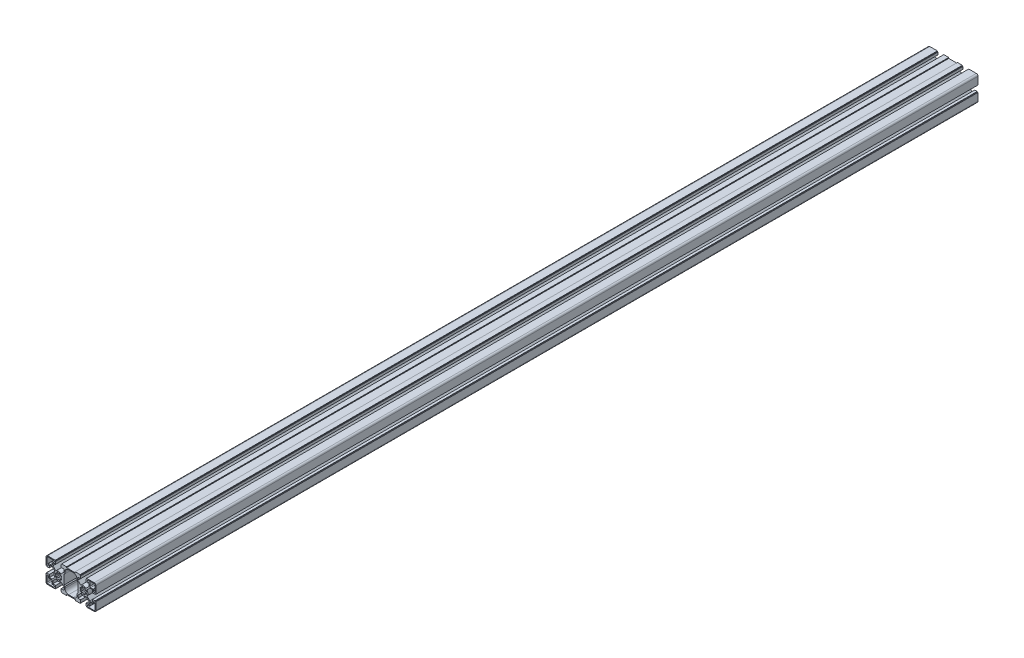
SolidWorks part; units mm, degrees
ref_plane "Front Plane" through (0, 0, 0) normal (0, 0, 1) x (1, 0, 0)
ref_plane "Top Plane" through (0, 0, 0) normal (0, 1, 0) x (1, 0, 0)
ref_plane "Right Plane" through (0, 0, 0) normal (1, 0, 0) x (0, 0, -1)
sketch "Sketch1" plane through (0, 0, 0) normal (0, 0, 1) x (1, 0, 0)
  line L0 (-27.5082, 0) -> (-17.5006, 0) construction
  line L1 (17.5006, 0) -> (27.5082, 0) construction
  line L2 (-42.0116, 22.5044) -> (-28.2956, 22.5044)
  line L3 (-28.2956, 22.5044) -> (-28.2956, 21.0058)
  line L4 (-28.2956, 21.0058) -> (-27.5082, 21.0058)
  line L5 (22.5044, -5.0038) -> (22.5044, 5.0038) construction
  line L6 (-27.5082, 21.0058) -> (-27.5082, 16.51)
  line L7 (-27.5082, 16.51) -> (-32.5501, 16.51)
  line L8 (-32.5501, 16.51) -> (-32.5501, 11.6801)
  line L9 (-32.5501, 11.6801) -> (-27.2854, 6.4154)
  line L11 (-34.1845, 10.0457) -> (-28.9198, 4.781)
  line L12 (-39.0144, 10.0457) -> (-34.1845, 10.0457)
  line L13 (-39.0144, 5.0038) -> (-39.0144, 10.0457)
  line L14 (-43.5102, 5.0038) -> (-39.0144, 5.0038)
  line L15 (-43.5102, 5.7912) -> (-43.5102, 5.0038)
  line L16 (-45.0088, 5.7912) -> (-43.5102, 5.7912)
  line L17 (-45.0088, 19.5072) -> (-45.0088, 5.7912)
  line L18 (-40.513, 11.5443) -> (-35.5473, 11.5443)
  line L19 (-40.513, 11.5443) -> (-40.513, 8.7884)
  line L20 (-34.0487, 18.0086) -> (-34.0487, 13.0429)
  line L21 (-43.5102, 19.5072) -> (-43.5102, 8.7884)
  line L23 (-34.0487, 18.0086) -> (-31.2928, 18.0086)
  line L24 (-42.0116, 21.0058) -> (-31.2928, 21.0058)
  line L25 (-21.3151, 5.9789) -> (-21.5282, 4.9077)
  line L26 (-23.6937, 5.9789) -> (-23.4806, 4.9077)
  line L27 (-17.4358, 3.3868) -> (-18.3439, 2.78)
  line L28 (-19.1176, 5.0686) -> (-19.7244, 4.1605)
  line L29 (-16.5255, -1.1893) -> (-17.5967, -0.9762)
  line L30 (-16.5255, 1.1893) -> (-17.5967, 0.9762)
  line L31 (-19.1176, -5.0686) -> (-19.7244, -4.1605)
  line L32 (-17.4358, -3.3868) -> (-18.3439, -2.78)
  line L33 (-23.6937, -5.9789) -> (-23.4806, -4.9077)
  line L34 (-21.3151, -5.9789) -> (-21.5282, -4.9077)
  line L35 (-27.573, -3.3868) -> (-26.6649, -2.78)
  line L36 (-25.8912, -5.0686) -> (-25.2844, -4.1605)
  line L37 (-28.4833, 1.1893) -> (-27.4121, 0.9762)
  line L38 (-28.4833, -1.1893) -> (-27.4121, -0.9762)
  line L39 (-25.8912, 5.0686) -> (-25.2844, 4.1605)
  line L40 (-27.573, 3.3868) -> (-26.6649, 2.78)
  line L41 (-7.8105, 22.5044) -> (-7.8105, 21.0058)
  line L42 (-7.8105, 21.0058) -> (7.8105, 21.0058)
  line L43 (-7.8105, 22.5044) -> (-16.7132, 22.5044)
  line L44 (-16.7132, 22.5044) -> (-16.7132, 21.0058)
  line L45 (-16.7132, 21.0058) -> (-17.5006, 21.0058)
  line L46 (-17.5006, 21.0058) -> (-17.5006, 16.51)
  line L47 (-17.5006, 16.51) -> (-12.4587, 16.51)
  line L48 (-12.4587, 16.51) -> (-12.4587, 11.6801)
  line L49 (-12.4587, 11.6801) -> (-17.7234, 6.4154)
  line L50 (-10.9601, 9.9099) -> (-12.4587, 8.4113)
  line L51 (7.8105, 21.0058) -> (7.8105, 22.5044)
  line L53 (-7.8105, -22.5044) -> (-16.7132, -22.5044)
  line L54 (7.8105, -22.5044) -> (16.7132, -22.5044)
  line L55 (7.8105, -21.0058) -> (7.8105, -22.5044)
  line L56 (-7.8105, -21.0058) -> (7.8105, -21.0058)
  line L57 (-7.8105, -22.5044) -> (-7.8105, -21.0058)
  line L58 (-40.513, -11.5443) -> (-35.5473, -11.5443)
  line L59 (4.3561, 19.5072) -> (-4.3561, 19.5072)
  line L60 (-10.9601, 12.9032) -> (-10.9601, 9.9099)
  line L61 (-12.4587, -8.4113) -> (-10.9601, -9.9099)
  line L62 (-12.4587, 8.4113) -> (-12.4587, -8.4113)
  line L63 (-10.9601, -12.9032) -> (-10.9601, -9.9099)
  line L64 (4.3561, -19.5072) -> (-4.3561, -19.5072)
  line L65 (10.9601, 12.9032) -> (10.9601, 9.9099)
  line L66 (10.9601, -12.9032) -> (10.9601, -9.9099)
  line L67 (12.4587, 8.4113) -> (12.4587, -8.4113)
  line L68 (10.9601, -9.9099) -> (12.4587, -8.4113)
  line L69 (10.9601, 9.9099) -> (12.4587, 8.4113)
  line L70 (-12.4587, -11.6801) -> (-17.7234, -6.4154)
  line L71 (-12.4587, -16.51) -> (-12.4587, -11.6801)
  line L72 (-17.5006, -16.51) -> (-12.4587, -16.51)
  line L73 (-17.5006, -21.0058) -> (-17.5006, -16.51)
  line L74 (-16.7132, -21.0058) -> (-17.5006, -21.0058)
  line L75 (-16.7132, -22.5044) -> (-16.7132, -21.0058)
  line L76 (-34.0487, -18.0086) -> (-31.2928, -18.0086)
  line L77 (-42.0116, -21.0058) -> (-31.2928, -21.0058)
  line L78 (-42.0116, -22.5044) -> (-28.2956, -22.5044)
  line L79 (-28.2956, -22.5044) -> (-28.2956, -21.0058)
  line L80 (-28.2956, -21.0058) -> (-27.5082, -21.0058)
  line L81 (-27.5082, -21.0058) -> (-27.5082, -16.51)
  line L82 (-27.5082, -16.51) -> (-32.5501, -16.51)
  line L83 (-32.5501, -16.51) -> (-32.5501, -11.6801)
  line L84 (-32.5501, -11.6801) -> (-27.2854, -6.4154)
  line L85 (-34.1845, -10.0457) -> (-28.9198, -4.781)
  line L86 (-43.5102, -19.5072) -> (-43.5102, -8.7884)
  line L87 (-34.0487, -18.0086) -> (-34.0487, -13.0429)
  line L88 (-40.513, -11.5443) -> (-40.513, -8.7884)
  line L89 (-45.0088, -19.5072) -> (-45.0088, -5.7912)
  line L90 (-45.0088, -5.7912) -> (-43.5102, -5.7912)
  line L91 (-43.5102, -5.7912) -> (-43.5102, -5.0038)
  line L92 (-43.5102, -5.0038) -> (-39.0144, -5.0038)
  line L93 (-39.0144, -5.0038) -> (-39.0144, -10.0457)
  line L94 (-39.0144, -10.0457) -> (-34.1845, -10.0457)
  line L96 (42.0116, 21.0058) -> (31.2928, 21.0058)
  line L97 (42.0116, 22.5044) -> (28.2956, 22.5044)
  line L98 (34.0487, 18.0086) -> (31.2928, 18.0086)
  line L99 (27.5082, 21.0058) -> (27.5082, 16.51)
  line L100 (28.2956, 21.0058) -> (27.5082, 21.0058)
  line L101 (28.2956, 22.5044) -> (28.2956, 21.0058)
  line L102 (17.5006, 21.0058) -> (17.5006, 16.51)
  line L103 (16.7132, 21.0058) -> (17.5006, 21.0058)
  line L104 (16.7132, 22.5044) -> (16.7132, 21.0058)
  line L105 (7.8105, 22.5044) -> (16.7132, 22.5044)
  line L106 (39.0144, -10.0457) -> (34.1845, -10.0457)
  line L107 (39.0144, -5.0038) -> (39.0144, -10.0457)
  line L108 (43.5102, -5.0038) -> (39.0144, -5.0038)
  line L109 (43.5102, -5.7912) -> (43.5102, -5.0038)
  line L110 (45.0088, -5.7912) -> (43.5102, -5.7912)
  line L111 (45.0088, -19.5072) -> (45.0088, -5.7912)
  line L112 (40.513, -11.5443) -> (35.5473, -11.5443)
  line L113 (40.513, -11.5443) -> (40.513, -8.7884)
  line L114 (34.0487, -18.0086) -> (34.0487, -13.0429)
  line L115 (43.5102, -19.5072) -> (43.5102, -8.7884)
  line L116 (34.1845, -10.0457) -> (28.9198, -4.781)
  line L117 (32.5501, -11.6801) -> (27.2854, -6.4154)
  line L118 (32.5501, -16.51) -> (32.5501, -11.6801)
  line L119 (27.5082, -16.51) -> (32.5501, -16.51)
  line L120 (27.5082, -21.0058) -> (27.5082, -16.51)
  line L121 (28.2956, -21.0058) -> (27.5082, -21.0058)
  line L122 (28.2956, -22.5044) -> (28.2956, -21.0058)
  line L123 (42.0116, -22.5044) -> (28.2956, -22.5044)
  line L124 (42.0116, -21.0058) -> (31.2928, -21.0058)
  line L125 (34.0487, -18.0086) -> (31.2928, -18.0086)
  line L126 (16.7132, -22.5044) -> (16.7132, -21.0058)
  line L127 (16.7132, -21.0058) -> (17.5006, -21.0058)
  line L128 (17.5006, -21.0058) -> (17.5006, -16.51)
  line L129 (17.5006, -16.51) -> (12.4587, -16.51)
  line L130 (12.4587, -16.51) -> (12.4587, -11.6801)
  line L131 (12.4587, -11.6801) -> (17.7234, -6.4154)
  line L132 (12.4587, 11.6801) -> (17.7234, 6.4154)
  line L133 (12.4587, 16.51) -> (12.4587, 11.6801)
  line L134 (27.573, 3.3868) -> (26.6649, 2.78)
  line L135 (25.8912, 5.0686) -> (25.2844, 4.1605)
  line L136 (28.4833, -1.1893) -> (27.4121, -0.9762)
  line L137 (28.4833, 1.1893) -> (27.4121, 0.9762)
  line L138 (25.8912, -5.0686) -> (25.2844, -4.1605)
  line L139 (27.573, -3.3868) -> (26.6649, -2.78)
  line L140 (21.3151, -5.9789) -> (21.5282, -4.9077)
  line L141 (23.6937, -5.9789) -> (23.4806, -4.9077)
  line L142 (17.4358, -3.3868) -> (18.3439, -2.78)
  line L143 (19.1176, -5.0686) -> (19.7244, -4.1605)
  line L144 (16.5255, 1.1893) -> (17.5967, 0.9762)
  line L145 (16.5255, -1.1893) -> (17.5967, -0.9762)
  line L146 (19.1176, 5.0686) -> (19.7244, 4.1605)
  line L147 (17.4358, 3.3868) -> (18.3439, 2.78)
  line L148 (23.6937, 5.9789) -> (23.4806, 4.9077)
  line L149 (21.3151, 5.9789) -> (21.5282, 4.9077)
  line L150 (43.5102, 19.5072) -> (43.5102, 8.7884)
  line L151 (34.0487, 18.0086) -> (34.0487, 13.0429)
  line L152 (40.513, 11.5443) -> (40.513, 8.7884)
  line L153 (40.513, 11.5443) -> (35.5473, 11.5443)
  line L154 (45.0088, 19.5072) -> (45.0088, 5.7912)
  line L155 (45.0088, 5.7912) -> (43.5102, 5.7912)
  line L156 (43.5102, 5.7912) -> (43.5102, 5.0038)
  line L157 (43.5102, 5.0038) -> (39.0144, 5.0038)
  line L158 (39.0144, 5.0038) -> (39.0144, 10.0457)
  line L159 (39.0144, 10.0457) -> (34.1845, 10.0457)
  line L160 (34.1845, 10.0457) -> (28.9198, 4.781)
  line L161 (32.5501, 11.6801) -> (27.2854, 6.4154)
  line L162 (32.5501, 16.51) -> (32.5501, 11.6801)
  line L163 (12.4587, 16.51) -> (17.5006, 16.51)
  line L164 (27.5082, 16.51) -> (32.5501, 16.51)
  arc A0 (-45.0088, 19.5072) -> (-42.0116, 22.5044) centre (-42.0116, 19.5072) cw
  arc A1 (-43.5102, 8.7884) -> (-40.513, 8.7884) centre (-42.0116, 8.7884) ccw
  arc A2 (-43.5102, 19.5072) -> (-42.0116, 21.0058) centre (-42.0116, 19.5072) cw
  arc A3 (-31.2928, 21.0058) -> (-31.2928, 18.0086) centre (-31.2928, 19.5072) cw
  arc A4 (-34.0487, 13.0429) -> (-35.5473, 11.5443) centre (-35.5473, 13.0429) cw
  arc A6 (-21.5282, 4.9077) -> (-23.4806, 4.9077) centre (-22.5044, 0) ccw
  arc A7 (-27.573, 3.3868) -> (-28.4833, 1.1893) centre (-22.5044, 0) ccw
  arc A8 (-18.3439, 2.78) -> (-19.7244, 4.1605) centre (-22.5044, 0) ccw
  arc A9 (-17.5967, -0.9762) -> (-17.5967, 0.9762) centre (-22.5044, 0) ccw
  arc A10 (-19.7244, -4.1605) -> (-18.3439, -2.78) centre (-22.5044, 0) ccw
  arc A11 (-23.4806, -4.9077) -> (-21.5282, -4.9077) centre (-22.5044, 0) ccw
  arc A12 (-26.6649, -2.78) -> (-25.2844, -4.1605) centre (-22.5044, 0) ccw
  arc A13 (-27.4121, 0.9762) -> (-27.4121, -0.9762) centre (-22.5044, 0) ccw
  arc A14 (-25.2844, 4.1605) -> (-26.6649, 2.78) centre (-22.5044, 0) ccw
  arc A15 (-28.4833, -1.1893) -> (-27.573, -3.3868) centre (-22.5044, 0) ccw
  arc A16 (-25.8912, -5.0686) -> (-23.6937, -5.9789) centre (-22.5044, 0) ccw
  arc A17 (-21.3151, -5.9789) -> (-19.1176, -5.0686) centre (-22.5044, 0) ccw
  arc A18 (-17.4358, -3.3868) -> (-16.5255, -1.1893) centre (-22.5044, 0) ccw
  arc A19 (-16.5255, 1.1893) -> (-17.4358, 3.3868) centre (-22.5044, 0) ccw
  arc A20 (-19.1176, 5.0686) -> (-21.3151, 5.9789) centre (-22.5044, 0) ccw
  arc A21 (-23.6937, 5.9789) -> (-25.8912, 5.0686) centre (-22.5044, 0) ccw
  arc A22 (-34.0487, -13.0429) -> (-35.5473, -11.5443) centre (-35.5473, -13.0429) ccw
  arc A23 (-4.3561, 19.5072) -> (-10.9601, 12.9032) centre (-4.3561, 12.9032) ccw
  arc A24 (-4.3561, -19.5072) -> (-10.9601, -12.9032) centre (-4.3561, -12.9032) cw
  arc A25 (4.3561, 19.5072) -> (10.9601, 12.9032) centre (4.3561, 12.9032) cw
  arc A26 (4.3561, -19.5072) -> (10.9601, -12.9032) centre (4.3561, -12.9032) ccw
  arc A27 (-31.2928, -21.0058) -> (-31.2928, -18.0086) centre (-31.2928, -19.5072) ccw
  arc A28 (-43.5102, -19.5072) -> (-42.0116, -21.0058) centre (-42.0116, -19.5072) ccw
  arc A29 (-45.0088, -19.5072) -> (-42.0116, -22.5044) centre (-42.0116, -19.5072) ccw
  arc A30 (-43.5102, -8.7884) -> (-40.513, -8.7884) centre (-42.0116, -8.7884) cw
  arc A31 (-17.7234, 6.4154) -> (-27.2854, 6.4154) centre (-22.5044, 0) ccw
  arc A32 (-27.2854, -6.4154) -> (-17.7234, -6.4154) centre (-22.5044, 0) ccw
  arc A33 (-28.9198, 4.781) -> (-28.9198, -4.781) centre (-22.5044, 0) ccw
  arc A34 (45.0088, 19.5072) -> (42.0116, 22.5044) centre (42.0116, 19.5072) ccw
  arc A35 (43.5102, 19.5072) -> (42.0116, 21.0058) centre (42.0116, 19.5072) ccw
  arc A36 (31.2928, 21.0058) -> (31.2928, 18.0086) centre (31.2928, 19.5072) ccw
  arc A37 (28.9198, 4.781) -> (28.9198, -4.781) centre (22.5044, 0) cw
  arc A38 (27.2854, -6.4154) -> (17.7234, -6.4154) centre (22.5044, 0) cw
  arc A39 (17.7234, 6.4154) -> (27.2854, 6.4154) centre (22.5044, 0) cw
  arc A40 (43.5102, -8.7884) -> (40.513, -8.7884) centre (42.0116, -8.7884) ccw
  arc A41 (34.0487, -13.0429) -> (35.5473, -11.5443) centre (35.5473, -13.0429) cw
  arc A42 (45.0088, -19.5072) -> (42.0116, -22.5044) centre (42.0116, -19.5072) cw
  arc A43 (43.5102, -19.5072) -> (42.0116, -21.0058) centre (42.0116, -19.5072) cw
  arc A44 (31.2928, -21.0058) -> (31.2928, -18.0086) centre (31.2928, -19.5072) cw
  arc A45 (23.6937, 5.9789) -> (25.8912, 5.0686) centre (22.5044, 0) cw
  arc A46 (19.1176, 5.0686) -> (21.3151, 5.9789) centre (22.5044, 0) cw
  arc A47 (16.5255, 1.1893) -> (17.4358, 3.3868) centre (22.5044, 0) cw
  arc A48 (17.4358, -3.3868) -> (16.5255, -1.1893) centre (22.5044, 0) cw
  arc A49 (21.3151, -5.9789) -> (19.1176, -5.0686) centre (22.5044, 0) cw
  arc A50 (25.8912, -5.0686) -> (23.6937, -5.9789) centre (22.5044, 0) cw
  arc A51 (28.4833, -1.1893) -> (27.573, -3.3868) centre (22.5044, 0) cw
  arc A52 (25.2844, 4.1605) -> (26.6649, 2.78) centre (22.5044, 0) cw
  arc A53 (27.4121, 0.9762) -> (27.4121, -0.9762) centre (22.5044, 0) cw
  arc A54 (26.6649, -2.78) -> (25.2844, -4.1605) centre (22.5044, 0) cw
  arc A55 (23.4806, -4.9077) -> (21.5282, -4.9077) centre (22.5044, 0) cw
  arc A56 (19.7244, -4.1605) -> (18.3439, -2.78) centre (22.5044, 0) cw
  arc A57 (17.5967, -0.9762) -> (17.5967, 0.9762) centre (22.5044, 0) cw
  arc A58 (18.3439, 2.78) -> (19.7244, 4.1605) centre (22.5044, 0) cw
  arc A59 (27.573, 3.3868) -> (28.4833, 1.1893) centre (22.5044, 0) cw
  arc A60 (21.5282, 4.9077) -> (23.4806, 4.9077) centre (22.5044, 0) cw
  arc A62 (34.0487, 13.0429) -> (35.5473, 11.5443) centre (35.5473, 13.0429) ccw
  arc A63 (43.5102, 8.7884) -> (40.513, 8.7884) centre (42.0116, 8.7884) cw
extrude "Boss-Extrude1" add sketch "Sketch1" along normal up to surface (1592.4022 mm away)
